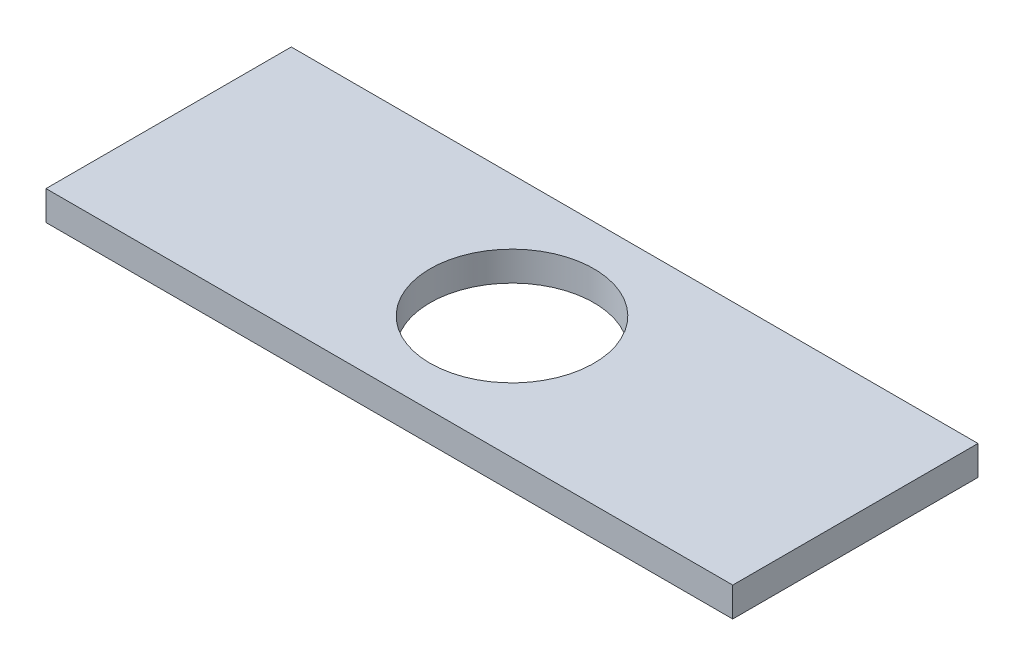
SolidWorks part; units mm, degrees
ref_plane "Front Plane" through (0, 0, 0) normal (0, 0, 1) x (1, 0, 0)
ref_plane "Top Plane" through (0, 0, 0) normal (0, 1, 0) x (1, 0, 0)
ref_plane "Right Plane" through (0, 0, 0) normal (1, 0, 0) x (0, 0, -1)
sketch "Sketch1" plane through (0, 0, 0) normal (0, 1, 0) x (1, 0, 0)
  line L0 (-70, 0) -> (70, 0) construction
  line L1 (-70, 25) -> (70, 25)
  line L2 (-70, 25) -> (-70, -25)
  line L3 (-70, -25) -> (70, -25)
  line L4 (70, 25) -> (70, -25)
  line L5 (0, 25) -> (0, -25) construction
  circle A0 centre (0, 0) radius 16.7
  dimension "D3" = 33.4
  dimension "D1" = 50
  dimension "D2" = 140
extrude "Extrude1" add sketch "Sketch1" along normal blind 6
